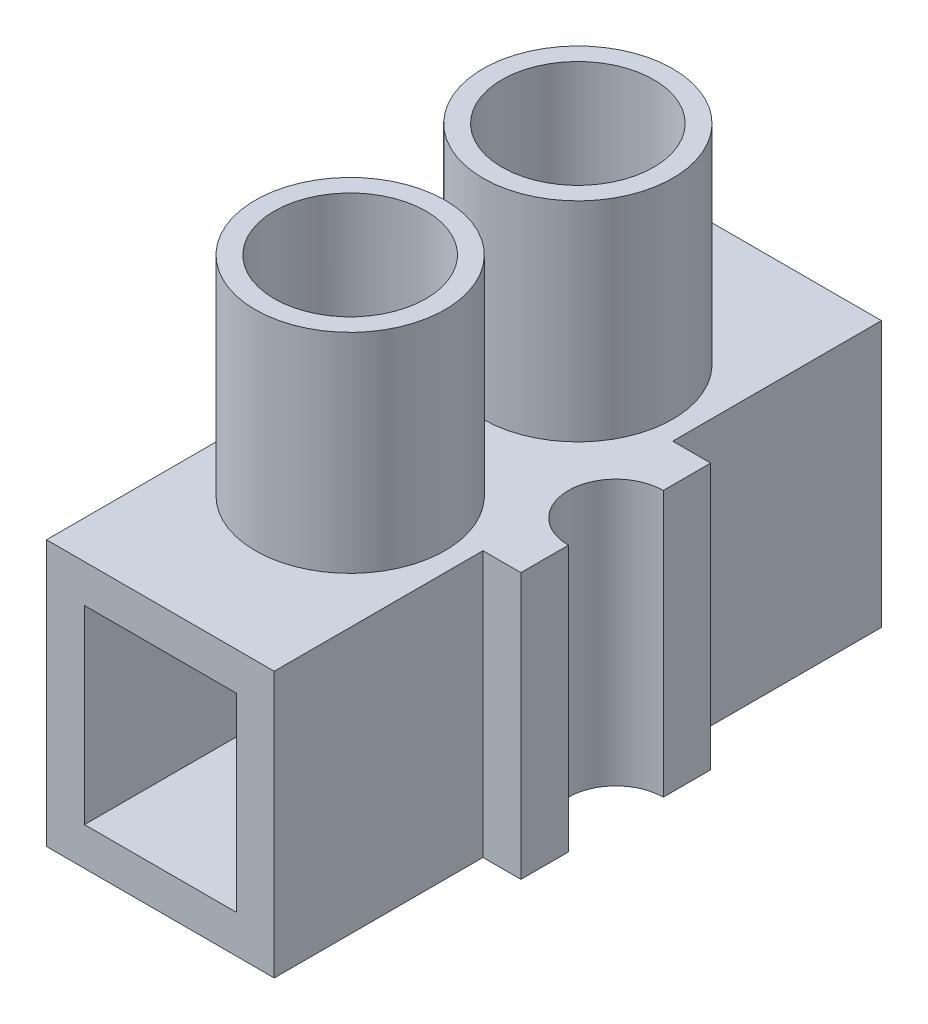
SolidWorks part; units mm, degrees
ref_plane "Plan de face" through (0, 0, 0) normal (0, 0, 1) x (1, 0, 0)
ref_plane "Plan de dessus" through (0, 0, 0) normal (0, 1, 0) x (1, 0, 0)
ref_plane "Plan de droite" through (0, 0, 0) normal (1, 0, 0) x (0, 0, -1)
sketch "Esquisse1" plane through (0, 0, 0) normal (0, 1, 0) x (1, 0, 0)
  line L0 (0, 25.0932) -> (0, -23.9151) construction
  line L1 (4, 23.9151) -> (4, -23.9151) construction
  line L2 (-53.8384, 0) -> (73.159, 0) construction
  line L3 (4, 2.5) -> (3, 2.5)
  line L4 (3, 2.5) -> (3, 8)
  line L5 (4, 2.5) -> (4, 1.25)
  line L6 (3, 8) -> (-3, 8)
  line L7 (-4, 2.5) -> (-4, 1.25)
  line L8 (-4, 2.5) -> (-3, 2.5)
  line L9 (-3, 2.5) -> (-3, 8)
  line L10 (4, -2.5) -> (4, -1.25)
  line L11 (4, -2.5) -> (3, -2.5)
  line L12 (3, -2.5) -> (3, -8)
  line L13 (3, -8) -> (-3, -8)
  line L14 (-3, -2.5) -> (-3, -8)
  line L15 (-4, -2.5) -> (-3, -2.5)
  line L16 (-4, -2.5) -> (-4, -1.25)
  arc A0 (4, 1.25) -> (4, -1.25) centre (4, 0) ccw
  arc A1 (-4, 1.25) -> (-4, -1.25) centre (-4, 0) cw
  point P13 (3, 5.25)
  point P21 (0, 8)
extrude "Boss.-Extru.1" add sketch "Esquisse1" along normal blind 7
sketch "Esquisse2" plane through (0, 7, 0) normal (0, 1, 0) x (1, 0, 0)
  line L0 (-2.75, 0) -> (2.75, 0) construction
  line L1 (0, 8) -> (0, -8) construction
  line L2 (3, 8) -> (-3, 8) construction
  line L3 (-3, -8) -> (3, -8) construction
  arc A0 (-4, -1.25) -> (-4, 1.25) centre (-4, 0) ccw construction
  arc A1 (4, 1.25) -> (4, -1.25) centre (4, 0) ccw construction
  circle A2 centre (0, 3) radius 2.5
  circle A3 centre (0, -3) radius 2.5
  dimension "D1" = 5
  dimension "D2" = 3
extrude "Boss.-Extru.2" add sketch "Esquisse2" along normal blind 5.5
sketch "Esquisse4" plane through (0, 0, 0) normal (0, 0, 1) x (1, 0, 0)
  line L0 (-3, 0) -> (3, 0) construction
  line L1 (-3, 7) -> (-3, 0) construction
  line L2 (-3, 7) -> (3, 7) construction
  line L3 (3, 7) -> (3, 0) construction
  line L4 (-3, 0) -> (3, 0) construction
  line L5 (-3, 7) -> (-3, 0) construction
  line L6 (-3, 7) -> (3, 7) construction
  line L7 (3, 7) -> (3, 0) construction
  line L8 (-2, 6) -> (2, 6)
  line L9 (2, 6) -> (2, 1)
  line L10 (-2, 1) -> (2, 1)
  line L11 (-2, 6) -> (-2, 1)
  dimension "D1" = 1
extrude "Enlèv. mat.-Extru.1" cut sketch "Esquisse4" against normal mid plane 25.5
sketch "Esquisse5" plane through (0, 12.5, 0) normal (0, 1, 0) x (1, 0, 0)
  line L0 (-2.75, 0) -> (2.75, 0) construction
  circle A0 centre (0, 3) radius 1.9999
  arc A1 (-4, -1.25) -> (-4, 1.25) centre (-4, 0) ccw construction
  arc A2 (4, 1.25) -> (4, -1.25) centre (4, 0) ccw construction
  circle A3 centre (0, -3) radius 1.9999
  dimension "D1" = 3.9998
extrude "Enlèv. mat.-Extru.2" cut sketch "Esquisse5" against normal up to surface (11.5 mm away)
equation "\"D1@Esquisse1\"=8/2"
